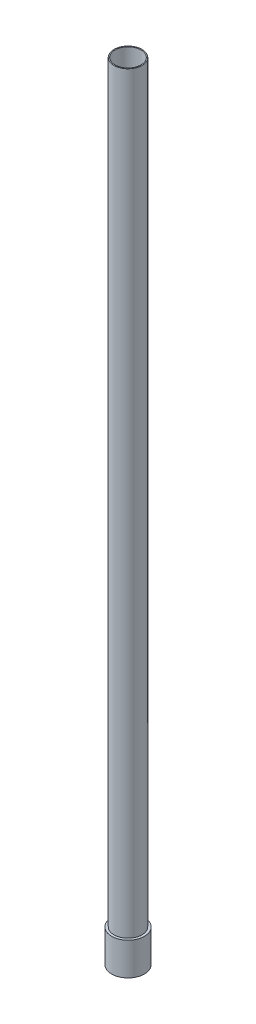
SolidWorks part; units mm, degrees
ref_plane "Front Plane" through (0, 0, 0) normal (0, 0, 1) x (1, 0, 0)
ref_plane "Top Plane" through (0, 0, 0) normal (0, 1, 0) x (1, 0, 0)
ref_plane "Right Plane" through (0, 0, 0) normal (1, 0, 0) x (0, 0, -1)
sketch "Sketch2" plane through (0, 0, 0) normal (0, 0, 1) x (1, 0, 0)
  line L0 (0, 0) -> (0, 304.8) construction
  line L1 (-5.0419, 0) -> (-6.35, 0)
  line L2 (-6.35, 0) -> (-6.35, 12.7)
  line L3 (-6.35, 12.7) -> (-5.4229, 12.7)
  line L4 (-5.4229, 12.7) -> (-5.4229, 304.8)
  line L5 (-5.4229, 304.8) -> (-5.0419, 304.8)
  line L6 (-5.0419, 0) -> (-5.0419, 304.8)
  dimension "D1" = 12.7
  dimension "D2" = 12.7
  dimension "D3" = 10.8458
  dimension "D4" = 304.8
  dimension "D5" = 10.0838
revolve "Revolve1" add sketch "Sketch2" angle 360 about L0
